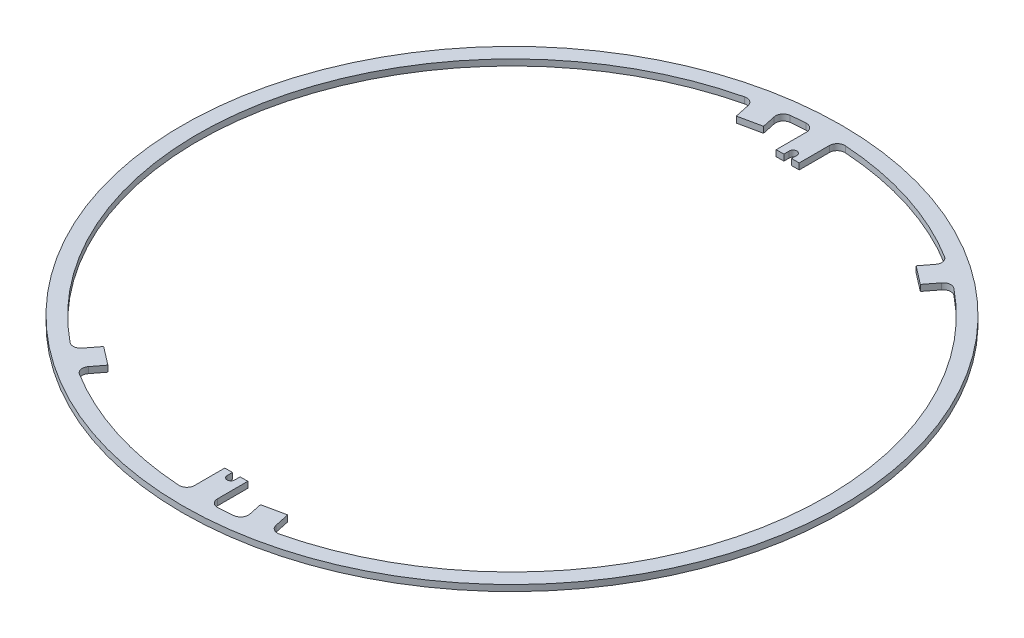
SolidWorks part; units mm, degrees
ref_plane "前视基准面" through (0, 0, 0) normal (0, 0, 1) x (1, 0, 0)
ref_plane "上视基准面" through (0, 0, 0) normal (0, 1, 0) x (1, 0, 0)
ref_plane "右视基准面" through (0, 0, 0) normal (1, 0, 0) x (0, 0, -1)
sketch "草图1" plane through (0, 0, 0) normal (0, 1, 0) x (1, 0, 0)
  circle A0 centre (0, 0) radius 43
  circle A1 centre (0, 0) radius 41
  circle A2 centre (0, 0) radius 35 construction
  dimension "D1" = 86
  dimension "D2" = 2
  dimension "D3" = 70
extrude "凸台-拉伸1" add sketch "草图1" along normal blind 0.8
sketch "草图2" plane through (0, 0.8, 0) normal (0, 1, 0) x (1, 0, 0)
  line L0 (0, 0) -> (0, 47.3857) construction
  line L1 (-1.5, 40.9726) -> (-1.5, 35.9726)
  line L2 (-1.5, 35.9726) -> (1.5, 35.9726)
  line L3 (1.5, 40.9726) -> (1.5, 35.9726)
  line L4 (0, 0) -> (51.4644, 0) construction
  line L5 (1.5, -40.9726) -> (1.5, -35.9726)
  line L6 (-1.5, -40.9726) -> (-1.5, -35.9726)
  line L7 (-1.5, -35.9726) -> (1.5, -35.9726)
  circle A0 centre (0, 0) radius 41 construction
  circle A1 centre (0, 0) radius 41
  point P10 (0, 35.9726)
  dimension "D1" = 5
  dimension "D2" = 3
extrude "凸台-拉伸2" add sketch "草图2" against normal up to surface (0.8 mm away) contours L7 L6 L5 M8 | L3 L1 L2 M8
fillet "圆角1" radius 1 2 edges at (1.5, 0.4, -40.9726) (-1.5, 0.4, -40.9726)
fillet "圆角2" radius 1 2 edges at (1.5, 0.4, 40.9726) (-1.5, 0.4, 40.9726)
sketch "草图3" plane through (0, 0, 0) normal (0, -1, 0) x (1, 0, 0)
  line L0 (0, 36.6726) -> (0, 35.9726) construction
  line L1 (1.5, 35.9726) -> (-1.5, 35.9726) construction
  line L2 (-0.5, 36.6726) -> (-0.5, 33.6726)
  line L3 (-0.5, 33.6726) -> (0.5, 33.6726)
  line L4 (0.5, 33.6726) -> (0.5, 36.6726)
  line L5 (0, 0) -> (11.294, 0) construction
  line L6 (0, -36.6726) -> (0, -35.9726) construction
  line L7 (0.5, -33.6726) -> (0.5, -36.6726)
  line L8 (-0.5, -33.6726) -> (0.5, -33.6726)
  line L9 (-0.5, -36.6726) -> (-0.5, -33.6726)
  arc A0 (0.5, 36.6726) -> (-0.5, 36.6726) centre (0, 36.6726) ccw
  arc A1 (0.5, -36.6726) -> (-0.5, -36.6726) centre (0, -36.6726) cw
  dimension "D1" = 1
  dimension "D2" = 3
  dimension "D3" = 0.7
extrude "切除-拉伸1" cut sketch "草图3" against normal through all
sketch "草图4" plane through (0, 0.8, 0) normal (0, 1, 0) x (1, 0, 0)
  line L0 (0, 0) -> (-24.9592, -32.5275) construction
  line L1 (0, 0) -> (0, -48.4381) construction
  line L2 (-24.9592, -32.5275) -> (-23.1329, -30.1474)
  line L3 (-23.1329, -30.1474) -> (-20.7529, -31.9737)
  line L4 (-20.7529, -31.9737) -> (-22.5123, -34.2666)
  line L5 (24.9592, 32.5275) -> (23.1329, 30.1474)
  line L6 (23.1329, 30.1474) -> (20.7529, 31.9737)
  line L7 (20.7529, 31.9737) -> (22.5123, 34.2666)
  arc A0 (-2.5625, 40.9198) -> (-2.5625, -40.9198) centre (0, 0) ccw construction
  arc A1 (-24.9592, -32.5275) -> (-22.5123, -34.2666) centre (0, 0) ccw
  arc A2 (24.9592, 32.5275) -> (22.5123, 34.2666) centre (0, 0) ccw
  point P16 (0, 0)
  dimension "D1" = 3
  dimension "D2" = 3
  dimension "D4" = 37.5
  dimension "D3" = 2
extrude "凸台-拉伸3" add sketch "草图4" against normal up to surface (0.8 mm away)
fillet "圆角3" radius 1 4 edges at (24.9592, 0.4, -32.5275) (22.5123, 0.4, -34.2666) (-22.5123, 0.4, 34.2666) (-24.9592, 0.4, 32.5275)
sketch "草图6" plane through (0, 0, 0) normal (0, -1, 0) x (1, 0, 0)
  line L0 (0, 0) -> (-23.1329, 30.1474) construction
  line L1 (0, 0) -> (8.5244, 40.1041) construction
  line L2 (8.5244, 40.1041) -> (7.9006, 37.1696)
  line L3 (7.9006, 37.1696) -> (4.9662, 37.7933)
  line L4 (4.9662, 37.7933) -> (5.5671, 40.6203)
  line L5 (-4.9662, -37.7933) -> (-5.5671, -40.6203)
  line L6 (-7.9006, -37.1696) -> (-4.9662, -37.7933)
  line L7 (-8.5244, -40.1041) -> (-7.9006, -37.1696)
  arc A0 (25.7646, -31.8933) -> (2.5625, 40.9198) centre (0, 0) ccw construction
  arc A1 (8.5244, 40.1041) -> (5.5671, 40.6203) centre (0, 0) ccw
  arc A2 (-8.5244, -40.1041) -> (-5.5671, -40.6203) centre (0, 0) ccw
  point P17 (0, 0)
  dimension "D1" = 49.5
  dimension "D2" = 3
  dimension "D3" = 3
  dimension "D4" = 2
extrude "凸台-拉伸4" add sketch "草图6" against normal up to surface (0.8 mm away)
fillet "圆角4" radius 1 4 edges at (-5.5671, 0.4, -40.6203) (-8.5244, 0.4, -40.1041) (5.5671, 0.4, 40.6203) (8.5244, 0.4, 40.1041)
